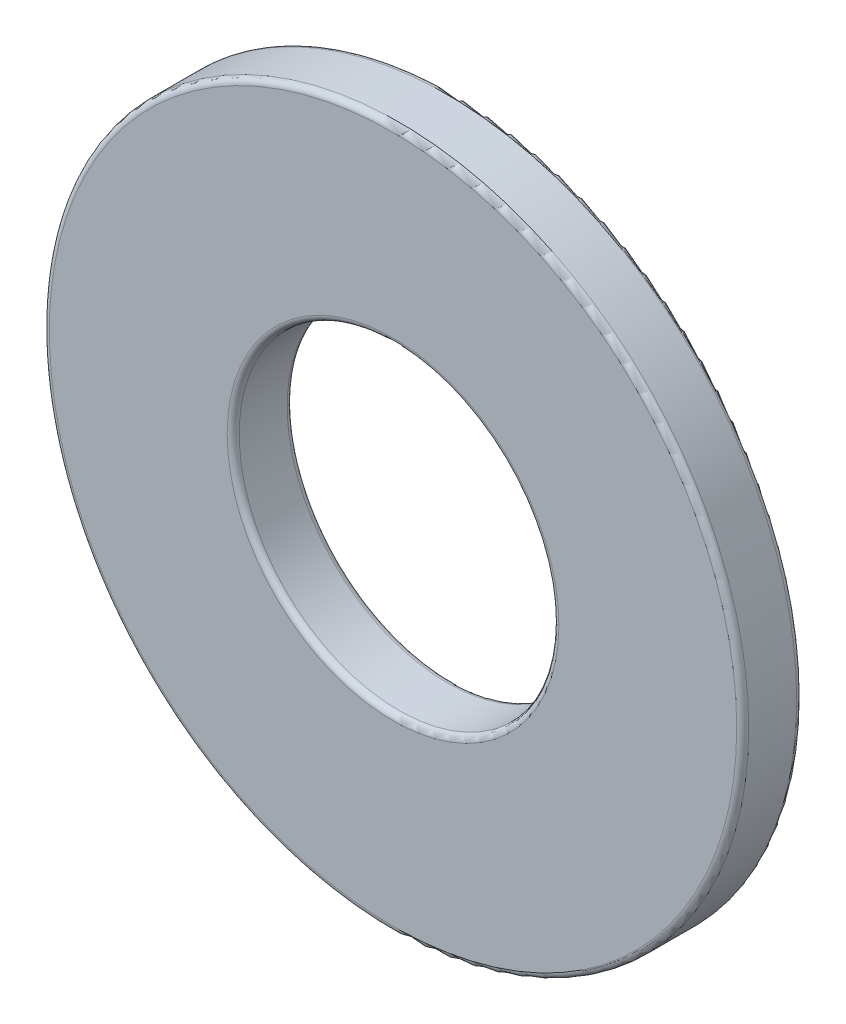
SolidWorks part; units mm, degrees
ref_plane "Front Plane" through (0, 0, 0) normal (0, 0, 1) x (1, 0, 0)
ref_plane "Top Plane" through (0, 0, 0) normal (0, 1, 0) x (1, 0, 0)
ref_plane "Right Plane" through (0, 0, 0) normal (1, 0, 0) x (0, 0, -1)
sketch "Sketch1" plane through (0, 0, 0) normal (0, 0, 1) x (1, 0, 0)
  circle A0 centre (0, 0) radius 3.5 construction
  circle A1 centre (0, 0) radius 1.6 construction
  dimension "OD" = 7
  dimension "ID" = 3.2
sketch "Sketch2" plane through (0, 0, 0) normal (1, 0, 0) x (0, 0, -1)
  line L0 (-0.3, -3.5) -> (0.3, -3.5) construction
  point P0 (0.1, -3.5)
  point P4 (0, -3.5)
sketch "Sketch3" plane through (0, 0, 0) normal (0, 0, 1) x (1, 0, 0)
  circle A0 centre (0, 0) radius 3.5 construction
  circle A1 centre (0, 0) radius 3.5
  circle A2 centre (0, 0) radius 1.6 construction
  circle A3 centre (0, 0) radius 1.6
extrude "Boss-Extrude1" add sketch "Sketch3" against normal up to vertex (0.3 mm away) and the other way up to vertex (0.3 mm away)
fillet "Fillet1" radius 0.06 4 edges at (3.5, 0, -0.3) (1.6, 0, -0.3) (1.6, 0, 0.3) (3.5, 0, 0.3)
equation "\"D1@Fillet1\" = \"Thickness Max@Sketch2\" * 0.1"
